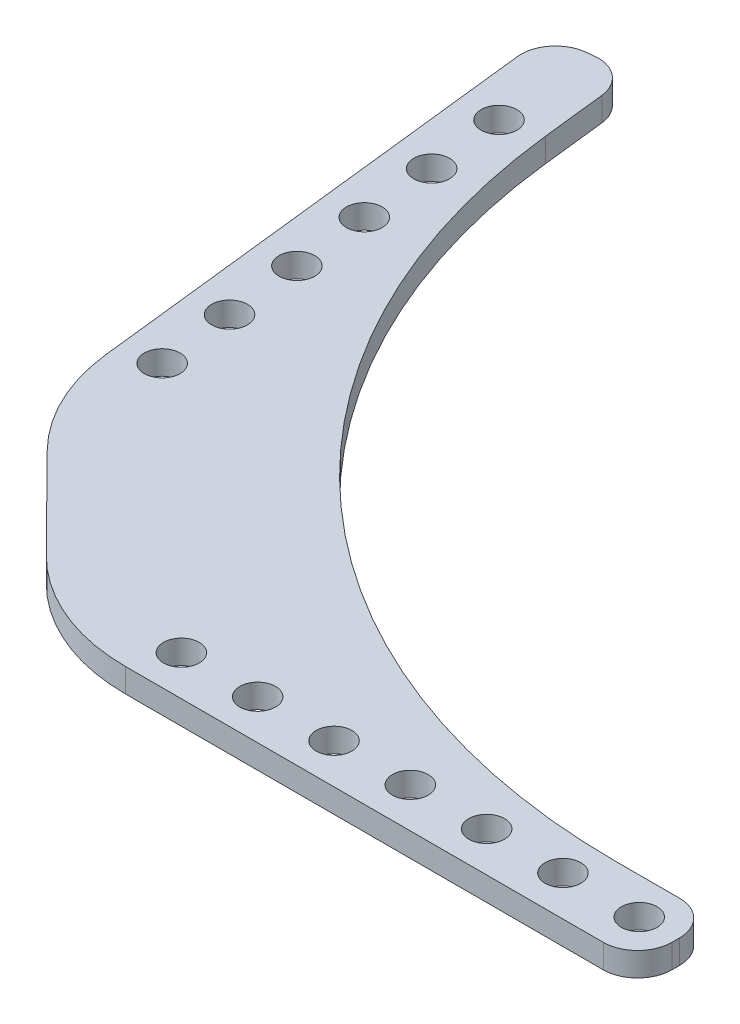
SolidWorks part; units mm, degrees
ref_plane "Front Plane" through (0, 0, 0) normal (0, 0, 1) x (1, 0, 0)
ref_plane "Top Plane" through (0, 0, 0) normal (0, 1, 0) x (1, 0, 0)
ref_plane "Right Plane" through (0, 0, 0) normal (1, 0, 0) x (0, 0, -1)
sketch "Sketch1" plane through (0, 0, 0) normal (0, 1, 0) x (1, 0, 0)
  line L0 (0, -4.572) -> (0, -5.588)
  line L1 (-4.572, -10.16) -> (-78.7949, -10.16)
  line L2 (-104.4489, 15.748) -> (-78.7949, -10.16)
  line L3 (-108.3722, 91.3111) -> (-107.3625, 91.424)
  line L4 (-102.3114, 87.3931) -> (-101.3559, 78.9287)
  line L5 (-13.0169, 0) -> (-4.572, 0)
  line L6 (-107.0979, 84.5725) -> (-104.2202, 58.8338) construction
  line L7 (-112.4084, 86.2642) -> (-104.4489, 15.748)
  line L8 (3.2683, -4.8497) -> (-8.7006, -4.8497) construction
  arc A0 (-101.3559, 78.9287) -> (-13.0169, 0) centre (-13.0169, 88.9) ccw
  arc A1 (0, -5.588) -> (-4.572, -10.16) centre (-4.572, -5.588) cw
  arc A2 (0, -4.572) -> (-4.572, 0) centre (-4.572, -4.572) ccw
  arc A3 (-107.3625, 91.424) -> (-102.3114, 87.3931) centre (-106.8545, 86.8803) cw
  arc A4 (-112.4084, 86.2642) -> (-108.3722, 91.3111) centre (-107.8642, 86.7674) cw
  circle A5 centre (-106.3319, 77.7216) radius 2.3813
  circle A6 centre (-5.0884, -4.8497) radius 2.3813
  circle A7 centre (-105.203, 67.6245) radius 2.3813
  circle A8 centre (-104.0741, 57.5274) radius 2.3813
  circle A9 centre (-102.9452, 47.4303) radius 2.3813
  circle A10 centre (-101.8163, 37.3332) radius 2.3813
  circle A11 centre (-100.6874, 27.2362) radius 2.3813
  circle A12 centre (-15.2484, -4.8497) radius 2.3813
  circle A13 centre (-25.4084, -4.8497) radius 2.3813
  circle A14 centre (-35.5684, -4.8497) radius 2.3812
  circle A15 centre (-45.7284, -4.8497) radius 2.3812
  circle A16 centre (-55.8884, -4.8497) radius 2.3812
  circle A18 centre (-66.0484, -4.8497) radius 2.3813
  circle A23 centre (-99.5585, 17.1391) radius 2.3813
  point P13 (0, -10.16)
  point P16 (0, 0)
  dimension "D6" = 88.9
  dimension "D8" = 4.572
  dimension "D12" = 4.7625
  dimension "D14" = 4.7625
  dimension "D1" = 25.654
  dimension "D2" = 10.16
  dimension "D3" = 25.908
  dimension "D4" = 10.16
  dimension "D5" = 96.44
  dimension "D7" = 96.379
  dimension "D11" = 7
  dimension "D13" = 7
extrude "Boss-Extrude1" add sketch "Sketch1" along normal blind 3.175
fillet "Fillet1" radius 25.4 2 edges at (-104.4489, 1.5875, -15.748) (-78.7949, 1.5875, 10.16)
